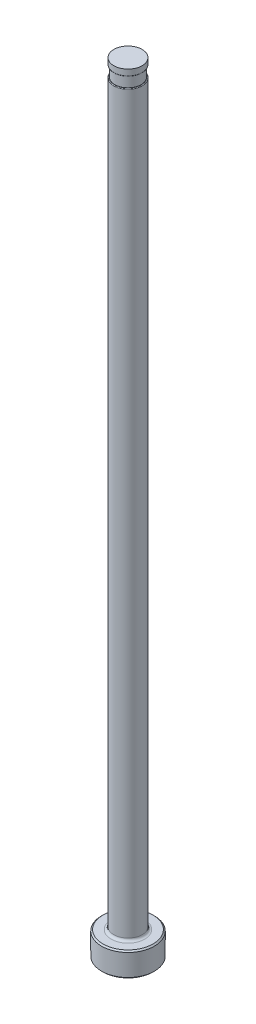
SolidWorks part; units mm, degrees
ref_plane "Front Plane" through (0, 0, 0) normal (0, 0, 1) x (1, 0, 0)
ref_plane "Top Plane" through (0, 0, 0) normal (0, 1, 0) x (1, 0, 0)
ref_plane "Right Plane" through (0, 0, 0) normal (1, 0, 0) x (0, 0, -1)
other "Configuration Table"
sketch "Sketch1" plane through (0, 0, 0) normal (0, 0, 1) x (1, 0, 0)
  line L0 (0, 259.9588) -> (0, -15.1925) construction
  line L1 (0, 0) -> (-5.1562, 0)
  line L2 (-5.1562, 0) -> (-5.1562, 4.7498)
  line L3 (-5.1562, 4.7498) -> (-2.7775, 4.7498)
  line L4 (-2.7775, 4.7498) -> (-2.7775, 152.4)
  line L5 (-2.7775, 152.4) -> (0, 152.4)
  line L6 (0, 152.4) -> (0, 0)
  dimension "L" = 152.4
  dimension "H" = 10.3124
  dimension "T" = 4.7498
  dimension "D" = 5.555
revolve "Revolve1" add sketch "Sketch1" angle 360 about L0
chamfer "Chamfer1" distance 0.254 angle 45 2 edges at (0, 4.7498, 5.1562) (0, 0, 5.1562)
fillet "Fillet1" radius 0.508 1 edges at (0, 4.7498, 2.7775)
sketch "Sketch2" plane through (0, 0, 0) normal (0, 0, 1) x (1, 0, 0)
  line L0 (-2.7775, 152.4) -> (-2.7775, 5.2578) construction
  line L1 (-2.7775, 151.13) -> (-2.5743, 151.13)
  line L2 (-2.7775, 151.13) -> (-2.7775, 149.098)
  line L3 (-2.7775, 149.098) -> (-2.5743, 149.098)
  line L4 (-2.5743, 151.13) -> (-2.5743, 149.098)
  line L5 (2.7775, 152.4) -> (-2.7775, 152.4) construction
  line L6 (0, 153.4483) -> (0, 147.3282) construction
  dimension "D1" = 2.032
  dimension "N" = 1.27
  dimension "FD" = 0.2032
  dimension "D3" = 5.1486
revolve "Vent Relief" cut sketch "Sketch2" angle 360 about L6
sketch "Sketch3" plane through (0, 0, 0) normal (0, 0, 1) x (1, 0, 0)
  line L0 (-2.5743, 150.114) -> (-2.5743, 86.614)
  line L1 (-2.5743, 151.13) -> (-2.5743, 149.098) construction
  line L2 (-2.7775, 149.098) -> (-2.7775, 5.2578) construction
  line L3 (-2.7775, 85.4964) -> (-2.7775, 150.114)
  line L4 (-2.7775, 150.114) -> (-2.5743, 150.114)
  arc A0 (-2.5743, 86.614) -> (-2.7775, 85.4964) centre (-5.7493, 86.614) cw
  dimension "D1" = 3.175
  dimension "D2" = 63.5
extrude "D-Slot" cut sketch "Sketch3" against normal through all both and the other way through all
sketch "Sketch5" plane through (0, 0, 0) normal (0, 0, 1) x (1, 0, 0)
  line L0 (-2.7775, 151.13) -> (2.7775, 151.13) construction
  line L1 (-2.7775, 152.4) -> (-2.7648, 152.4)
  line L2 (-2.7775, 152.4) -> (-2.7775, 151.13)
  line L3 (-2.7775, 151.13) -> (-2.7648, 151.13)
  line L4 (-2.7648, 152.4) -> (-2.7648, 151.13)
  line L5 (0, 152.6877) -> (0, 150.5771) construction
  dimension "VP" = 0.0127
revolve "Vent Diameter" cut sketch "Sketch5" angle 360 about L5
fillet "Fillet2" radius 0.127 2 edges at (2.7775, 149.098, 0) (0, 151.13, 2.7648)
sketch "Pocket Sketch" plane through (0, 0, 0) normal (0, 0, 1) x (1, 0, 0)
  line L0 (-5.5531, 0) -> (-5.5531, 4.7752)
  line L1 (-5.5531, 4.7752) -> (-3.7379, 4.7752)
  line L2 (-2.9759, 5.5372) -> (-2.9759, 22.225)
  line L3 (-2.9759, 22.225) -> (0, 22.225)
  line L4 (0, 22.225) -> (0, 0)
  line L5 (0, 0) -> (-5.5531, 0)
  line L6 (0, 12.6104) -> (0, -2.4989) construction
  line L7 (-5.1562, 4.4958) -> (-5.1562, 0.254) construction
  line L8 (4.9022, 4.7498) -> (-4.9022, 4.7498) construction
  line L9 (-2.7775, 85.4964) -> (-2.7775, 5.2578) construction
  line L10 (-3.7379, 4.7752) -> (-2.9759, 5.5372)
  point P3 (-2.9759, 4.7752)
  dimension "D1" = 11.1061
  dimension "D2" = 0.3969
  dimension "D3" = 0.0254
  dimension "D4" = 0.1984
  dimension "D5" = 5.9519
  dimension "D6" = 22.225
